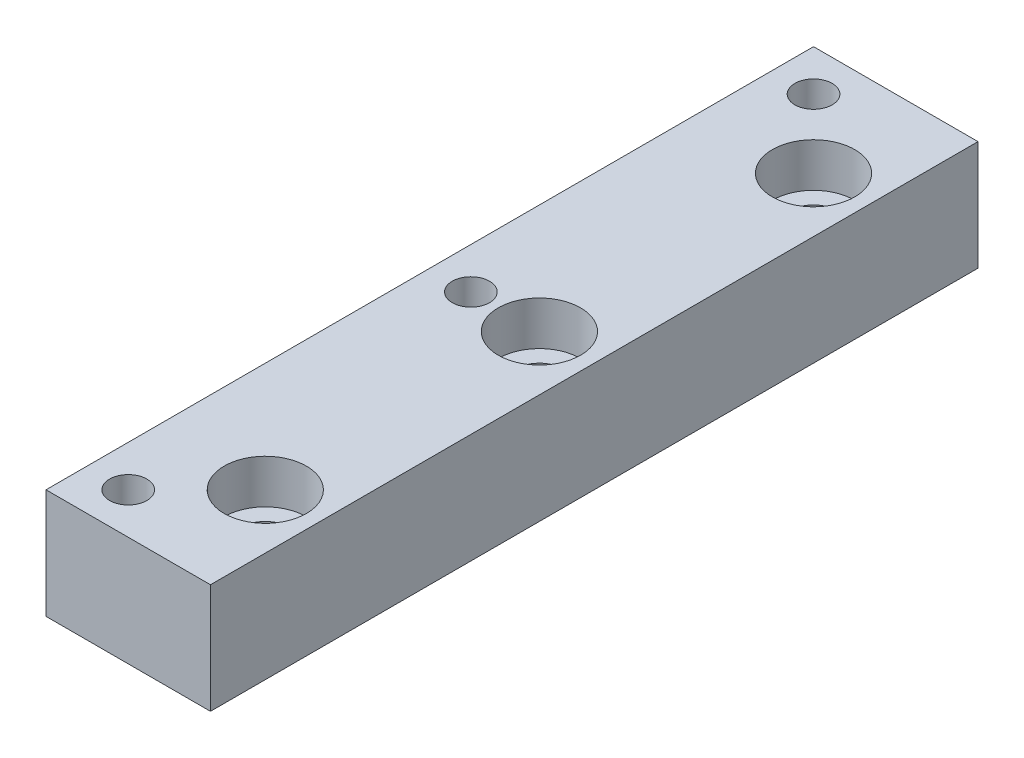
SolidWorks part; units mm, degrees
ref_plane "Plan de face" through (0, 0, 0) normal (0, 0, 1) x (1, 0, 0)
ref_plane "Plan de dessus" through (0, 0, 0) normal (0, 1, 0) x (1, 0, 0)
ref_plane "Plan de droite" through (0, 0, 0) normal (1, 0, 0) x (0, 0, -1)
sketch "Esquisse1" plane through (0, 0, 0) normal (0, 0, 1) x (1, 0, 0)
  line L1 (0, 0) -> (30, 0)
  line L2 (0, 0) -> (0, 20)
  line L3 (0, 20) -> (30, 20)
  line L4 (30, 0) -> (30, 20)
  dimension "D1" = 20
  dimension "D2" = 30
extrude "Extrusion1" add sketch "Esquisse1" against normal mid plane 140
hole_wizard "Trou taraudé M81" positions "Esquisse3" profile "Esquisse2" tap size "M8" standard "ISO"
sketch "Esquisse3" plane through (0, 20, 0) normal (0, 1, 0) x (-1, 0, 0)
  line L0 (0, -70) -> (0, 70) construction
  point P0 (-7.5, 62.5)
  point P1 (-7.5, 0)
  point P3 (-7.5, -62.5)
  dimension "D1" = 7.5
sketch "Esquisse2" plane through (7.5, 20, 62.5) normal (1, 0, 0) x (0, 0, 1)
  line L0 (0, 0) -> (0, 20)
  line L1 (0, 20) -> (3.4, 20)
  line L2 (3.4, 20) -> (3.4, 0)
  line L5 (3.4, 0) -> (0, 0)
  line L11 (0, -6.35) -> (0, 107.95) construction
  dimension "Diamètre du trou pour taraudage jusqu'au prochain" = 6.8
  dimension "Profondeur du trou pour taraudage jusqu'au prochain" = 20
hole_wizard "Chambrage pour axes 8.5 mm1" positions "Esquisse5" profile "Esquisse4" counterbore size "8.5" standard "HASCO Métrique"
sketch "Esquisse5" plane through (0, 20, 0) normal (0, 1, 0) x (-1, 0, 0)
  line L0 (-30, -70) -> (-30, 70) construction
  point P0 (-20, 50)
  point P1 (-20, 0)
  point P3 (-20, -50)
  dimension "D2" = 10
sketch "Esquisse4" plane through (20, 20, 50) normal (1, 0, 0) x (0, 0, 1)
  line L0 (0, 0) -> (0, 20)
  line L1 (0, 20) -> (4.25, 20)
  line L3 (4.25, 20) -> (4.25, 8)
  line L4 (4.25, 8) -> (7.5, 8)
  line L5 (7.5, 8) -> (7.5, 0)
  line L7 (7.5, 0) -> (0, 0)
  line L11 (0, -6.35) -> (0, 107.95) construction
  dimension "Diamètre du perçage jusqu'au prochain" = 8.5
  dimension "Profondeur du perçage jusqu'au prochain" = 20
  dimension "Diamètre du chambrage" = 15
  dimension "Profondeur du chambrage" = 8
